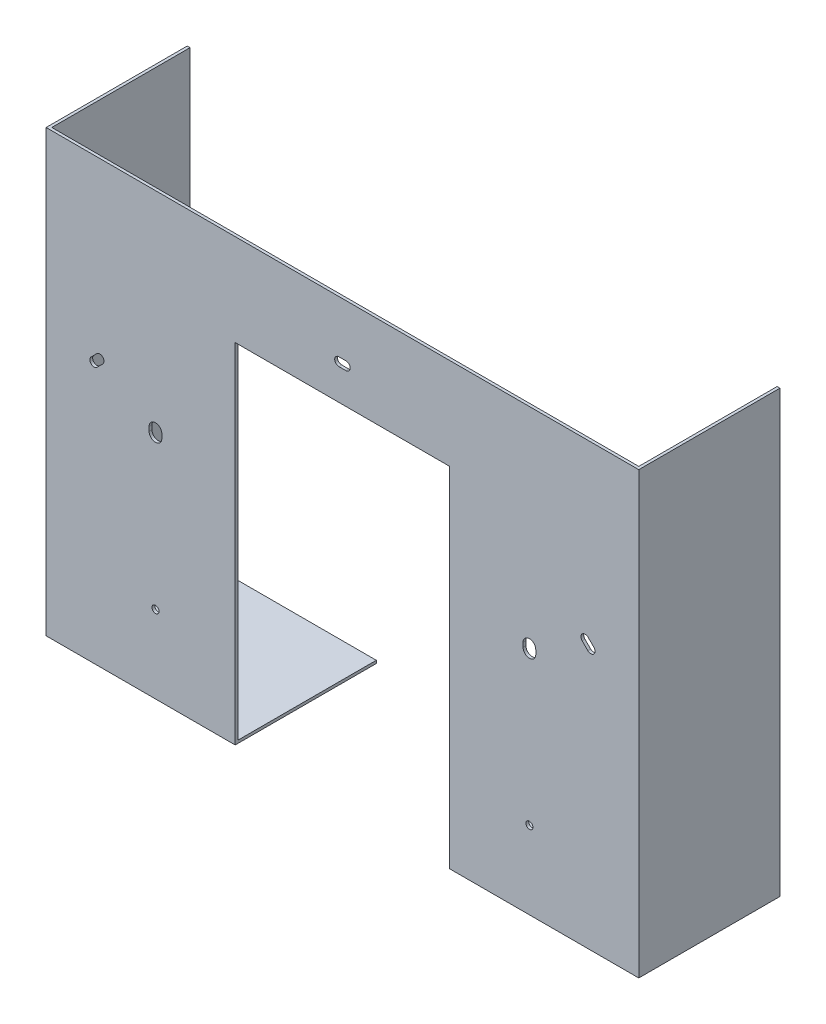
SolidWorks part; units mm, degrees
ref_plane "Face" through (0, 0, 0) normal (0, 0, 1) x (1, 0, 0)
ref_plane "Dessus" through (0, 0, 0) normal (0, 1, 0) x (1, 0, 0)
ref_plane "Droite" through (0, 0, 0) normal (1, 0, 0) x (0, 0, -1)
sketch "Esquisse1" plane through (0, 0, 0) normal (0, 0, 1) x (1, 0, 0)
  line L1 (0, 0) -> (420, 0)
  line L2 (0, 0) -> (0, 312)
  line L3 (0, 312) -> (420, 312)
  line L4 (420, 0) -> (420, 312)
extrude "Extrusion1" add sketch "Esquisse1" along normal blind 100
shell "Coque1" thickness 2
sketch "Esquisse2" plane through (0, 0, 100) normal (0, 0, 1) x (1, 0, 0)
  line L1 (134, 247) -> (286, 247)
  line L2 (134, 247) -> (134, -22.4472)
  line L3 (134, -22.4472) -> (286, -22.4472)
  line L4 (286, 247) -> (286, -22.4472)
extrude "Enlèv. mat.-Extru.1" cut sketch "Esquisse2" against normal through all
sketch "Esquisse3" plane through (0, 0, 100) normal (0, 0, 1) x (1, 0, 0)
  circle A0 centre (77.5, 55) radius 2.5
  circle A1 centre (342.5, 55) radius 2.5
extrude "Enlèv. mat.-Extru.2" cut sketch "Esquisse3" against normal blind 100
sketch "Esquisse4" plane through (0, 0, 100) normal (0, 0, 1) x (1, 0, 0)
  line L0 (73, 165) -> (73, 162)
  line L1 (82, 165) -> (82, 162)
  line L2 (347, 165) -> (347, 162)
  line L3 (338, 165) -> (338, 162)
  arc A0 (73, 162) -> (82, 162) centre (77.5, 162) ccw
  arc A1 (82, 165) -> (73, 165) centre (77.5, 165) ccw
  arc A2 (338, 162) -> (347, 162) centre (342.5, 162) ccw
  arc A3 (347, 165) -> (338, 165) centre (342.5, 165) ccw
extrude "Enlèv. mat.-Extru.3" cut sketch "Esquisse4" against normal blind 100
sketch "Esquisse5" plane through (0, 0, 100) normal (0, 0, 1) x (1, 0, 0)
  line L0 (207.5, 275) -> (212.5, 275)
  line L1 (207.5, 269) -> (212.5, 269)
  arc A0 (207.5, 275) -> (207.5, 269) centre (207.5, 272) ccw
  arc A1 (212.5, 269) -> (212.5, 275) centre (212.5, 272) ccw
extrude "Enlèv. mat.-Extru.4" cut sketch "Esquisse5" against normal blind 100
sketch "Esquisse6" plane through (0, 0, 100) normal (0, 0, 1) x (1, 0, 0)
  line L0 (31.8787, 187.1213) -> (35.8787, 191.1213)
  line L1 (36.1213, 182.8787) -> (40.1213, 186.8787)
  line L6 (388.1213, 187.1213) -> (384.1213, 191.1213)
  line L7 (383.8787, 182.8787) -> (379.8787, 186.8787)
  arc A0 (31.8787, 187.1213) -> (36.1213, 182.8787) centre (34, 185) ccw
  arc A1 (40.1213, 186.8787) -> (35.8787, 191.1213) centre (38, 189) ccw
  arc A4 (379.8787, 186.8787) -> (384.1213, 191.1213) centre (382, 189) cw
  arc A5 (388.1213, 187.1213) -> (383.8787, 182.8787) centre (386, 185) cw
extrude "Enlèv. mat.-Extru.5" cut sketch "Esquisse6" against normal blind 100
sketch "Esquisse7" plane through (0, 0, 0) normal (0, -1, 0) x (1, 0, 0)
  line L0 (91, 76) -> (91, 67)
  line L1 (79, 76) -> (79, 67)
  line L2 (341, 76) -> (341, 67)
  line L3 (329, 76) -> (329, 67)
  arc A0 (79, 67) -> (91, 67) centre (85, 67) ccw
  arc A1 (91, 76) -> (79, 76) centre (85, 76) ccw
  arc A2 (341, 76) -> (329, 76) centre (335, 76) ccw
  arc A3 (329, 67) -> (341, 67) centre (335, 67) ccw
extrude "Enlèv. mat.-Extru.6" cut sketch "Esquisse7" against normal blind 100
